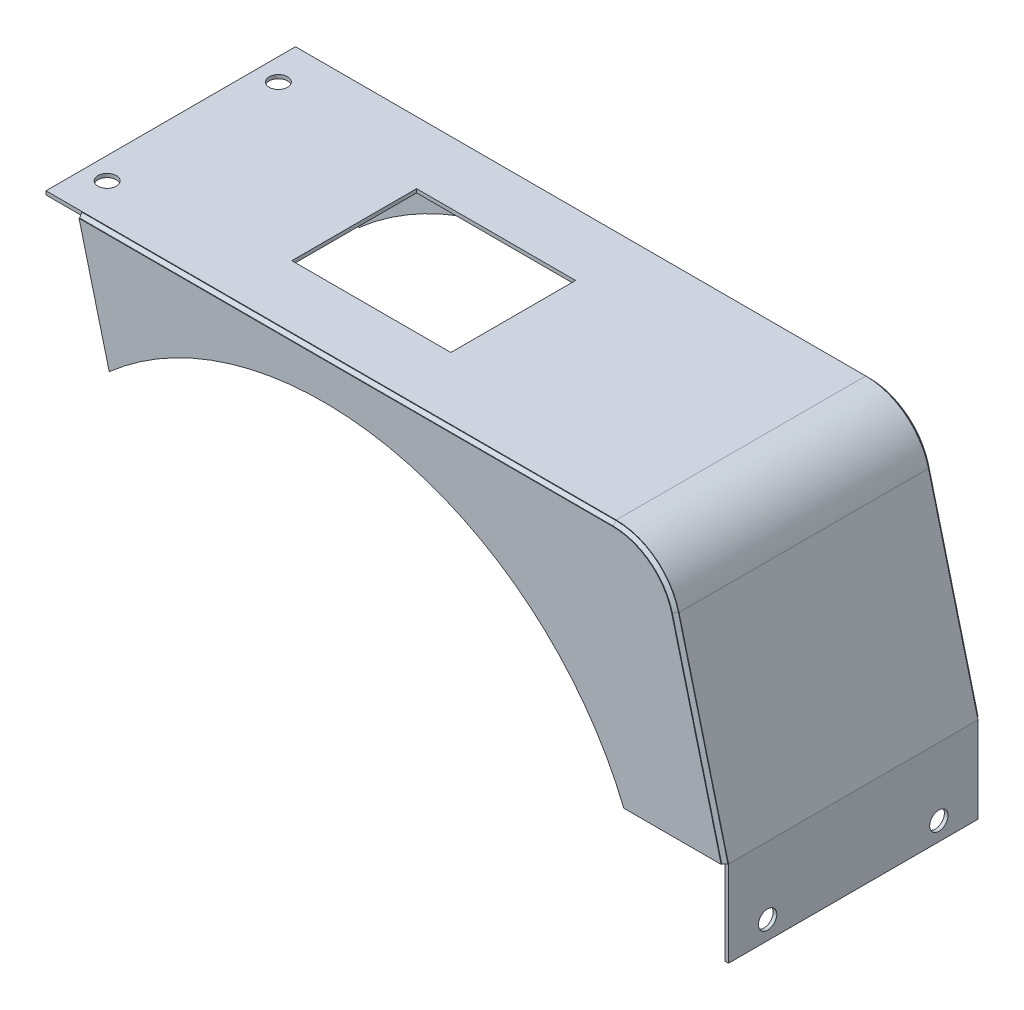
SolidWorks part; units mm, degrees
other "Objet de détail2"
other "Objet de détail3"
ref_plane "Face" through (0, 0, 0) normal (0, 0, 1) x (1, 0, 0)
ref_plane "Dessus" through (0, 0, 0) normal (0, 1, 0) x (1, 0, 0)
ref_plane "Droite" through (0, 0, 0) normal (1, 0, 0) x (0, 0, -1)
sketch "Esquisse1" plane through (0, 0, 0) normal (0, 0, 1) x (1, 0, 0)
  line L0 (-457.5928, 52.5378) -> (8.6102, 52.5378)
  line L1 (57.0434, 14.9566) -> (97.4072, -142.4622)
  line L2 (97.4072, -142.4622) -> (97.4072, -212.4622)
  line L3 (-457.5928, 55.5378) -> (8.6102, 55.5378)
  line L4 (59.9494, 15.7017) -> (100.4072, -142.0837)
  line L5 (100.4072, -142.0837) -> (100.4072, -212.4622)
  line L6 (97.4072, -212.4622) -> (100.4072, -212.4622)
  line L7 (-457.5928, 55.5378) -> (-457.5928, 52.5378)
  arc A0 (8.6102, 52.5378) -> (57.0434, 14.9566) centre (8.6102, 2.5378) cw
  arc A1 (8.6102, 55.5378) -> (59.9494, 15.7017) centre (8.6102, 2.5378) cw
  point P6 (47.4072, 52.5378)
  dimension "D5" = 50
  dimension "D1" = 555
  dimension "D2" = 195
  dimension "D3" = 70
  dimension "D4" = 50
  dimension "D6" = 3
extrude "Extrusion1" add sketch "Esquisse1" along normal blind 204
sketch "Esquisse3" plane through (0, 0, 204) normal (0, 0, 1) x (1, 0, 0)
  line L0 (57.0434, 14.9566) -> (97.4072, -142.4622) construction
  line L1 (-457.5928, 52.5378) -> (8.6102, 52.5378) construction
  line L2 (57.0434, 14.9566) -> (97.4072, -142.4622)
  line L3 (-427.5928, 52.5378) -> (8.6102, 52.5378)
  line L4 (97.4072, -142.4622) -> (-377.5928, -142.4622)
  line L5 (-427.5928, 52.5378) -> (-377.5928, -142.4622)
  arc A0 (57.0434, 14.9566) -> (8.6102, 52.5378) centre (8.6102, 2.5378) ccw construction
  arc A1 (57.0434, 14.9566) -> (8.6102, 52.5378) centre (8.6102, 2.5378) ccw
  dimension "D1" = 50
  dimension "D2" = 525
extrude "Extrusion2" add sketch "Esquisse3" along normal mid plane 6 separate body
sketch "Esquisse4" plane through (0, 0, 0) normal (0, 0, -1) x (-1, 0, 0)
  line L0 (-97.4072, -142.4622) -> (-57.0434, 14.9566) construction
  line L1 (-8.6102, 52.5378) -> (427.5928, 52.5378) construction
  line L2 (-97.4072, -142.4622) -> (-57.0434, 14.9566)
  line L3 (-8.6102, 52.5378) -> (427.5928, 52.5378)
  line L4 (427.5928, 52.5378) -> (377.5928, -142.4622)
  line L5 (427.5928, 52.5378) -> (377.5928, -142.4622) construction
  line L6 (-97.4072, -142.4622) -> (377.5928, -142.4622)
  arc A0 (-8.6102, 52.5378) -> (-57.0434, 14.9566) centre (-8.6102, 2.5378) ccw construction
  arc A1 (-8.6102, 52.5378) -> (-57.0434, 14.9566) centre (-8.6102, 2.5378) ccw
extrude "Extrusion3" add sketch "Esquisse4" along normal mid plane 6 separate body
other "Cordon de soudure d'angle2" parameters "D10"=6, "D11"=2.5, "D12"=0, "D13"=3, "D14"=0
other "Cordon de soudure d'angle3" parameters "D10"=6, "D11"=2.5, "D12"=0, "D13"=3, "D14"=0
sketch "Esquisse6" plane through (0, 55.5378, 0) normal (0, 1, 0) x (-1, 0, 0)
  line L0 (-8.6102, 204) -> (457.5928, 204) construction
  line L1 (457.5928, 204) -> (457.5928, 0) construction
  circle A0 centre (439.5928, 172) radius 7.5
  circle A1 centre (439.5928, 32) radius 7.5
  dimension "D1" = 15
  dimension "D3" = 18
  dimension "D4" = 15
  dimension "D5" = 140
  dimension "D2" = 32
extrude "Enlèv. mat.-Extru.1" cut sketch "Esquisse6" against normal blind 6
sketch "Esquisse7" plane through (100.4072, 0, 0) normal (1, 0, 0) x (0, 0, -1)
  line L8 (-204, -212.4622) -> (0, -212.4622) construction
  line L9 (-204, -212.4622) -> (-204, -142.0837) construction
  circle A0 centre (-172, -197.4622) radius 7.5
  circle A1 centre (-32, -197.4622) radius 7.5
  dimension "D5" = 15
  dimension "D6" = 15
  dimension "D7" = 32
  dimension "D1" = 15
  dimension "D2" = 140
extrude "Enlèv. mat.-Extru.2" cut sketch "Esquisse7" against normal blind 3
sketch "Esquisse9" plane through (0, 0, -3) normal (0, 0, -1) x (-1, 0, 0)
  line L0 (-97.4072, -142.4622) -> (377.5928, -142.4622) construction
  circle A0 centre (227.5928, -242.4622) radius 265
  dimension "D1" = 530
  dimension "D2" = 100
  dimension "D3" = 200
extrude "Enlèv. mat.-Extru.3" cut sketch "Esquisse9" against normal blind 10
sketch "Esquisse10" plane through (0, 55.5378, 0) normal (0, 1, 0) x (-1, 0, 0)
  line L1 (177.5928, 51) -> (307.5928, 51)
  line L2 (177.5928, 51) -> (177.5928, 153)
  line L3 (177.5928, 153) -> (307.5928, 153)
  line L4 (307.5928, 51) -> (307.5928, 153)
  line L5 (-8.6102, 204) -> (457.5928, 204) construction
  line L6 (457.5928, 204) -> (457.5928, 0) construction
  dimension "D1" = 102
  dimension "D2" = 130
  dimension "D3" = 51
  dimension "D4" = 150
extrude "Enlèv. mat.-Extru.4" cut sketch "Esquisse10" against normal blind 10
sketch "Esquisse11" plane through (0, 0, 207) normal (0, 0, 1) x (1, 0, 0)
  line L0 (-377.5928, -142.4622) -> (97.4072, -142.4622) construction
  circle A0 centre (-227.5928, -242.4622) radius 265
  dimension "D1" = 530
  dimension "D2" = 100
  dimension "D3" = 200
extrude "Enlèv. mat.-Extru.5" cut sketch "Esquisse11" against normal blind 10
